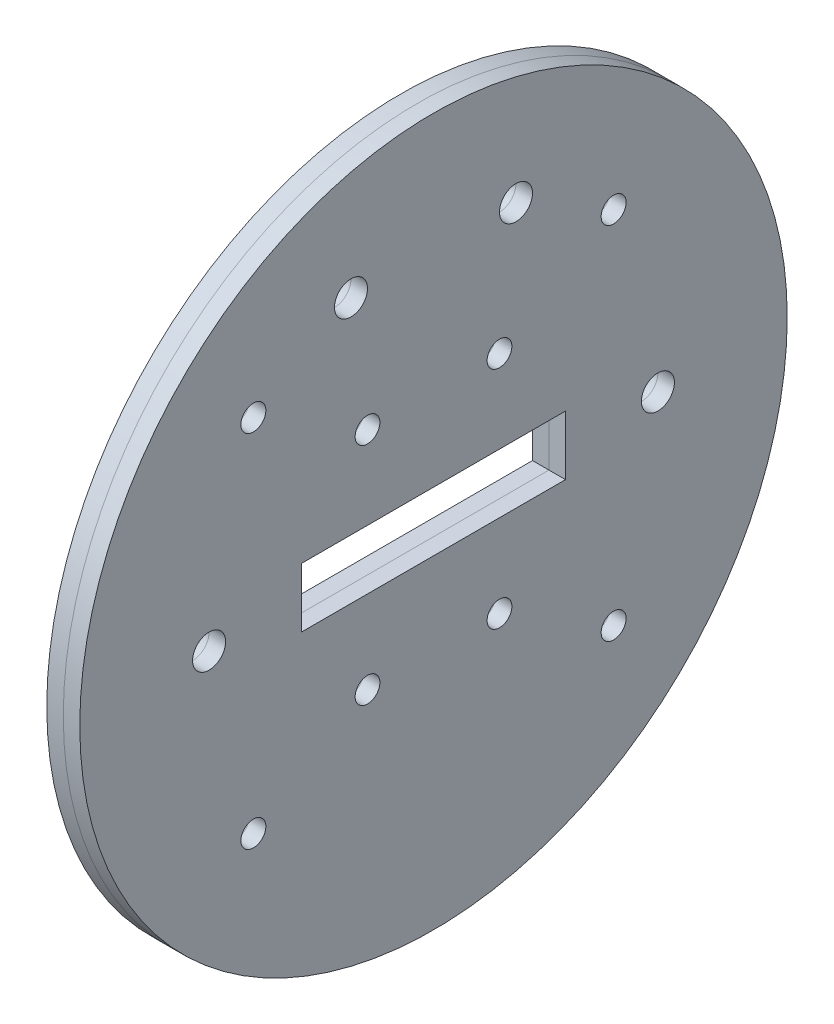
SolidWorks part; units mm, degrees
ref_plane "Front Plane" through (0, 0, 0) normal (0, 0, 1) x (1, 0, 0)
ref_plane "Top Plane" through (0, 0, 0) normal (0, 1, 0) x (1, 0, 0)
ref_plane "Right Plane" through (0, 0, 0) normal (1, 0, 0) x (0, 0, -1)
sketch "Sketch1" plane through (0, 0, 0) normal (1, 0, 0) x (0, 0, -1)
  circle A0 centre (0, 0) radius 68.072
  dimension "D1" = 136.144
extrude "Boss-Extrude1" add sketch "Sketch1" along normal blind 3.175
sketch "Sketch4" plane through (3.175, 0, 0) normal (1, 0, 0) x (0, 0, -1)
  circle A0 centre (0, 0) radius 68.072
extrude "Boss-Extrude2" add sketch "Sketch4" along normal blind 3.175 separate body
sketch "Sketch2" plane through (3.175, 0, 0) normal (1, 0, 0) x (0, 0, -1)
  line L0 (0, 68.072) -> (0, -68.072) construction
  circle A3 centre (0, 0) radius 68.072 construction
  circle A4 centre (43.18, 0) radius 3.175
  circle A5 centre (-43.18, 0) radius 3.175
  point P6 (0, 0)
  dimension "D1" = 6.35
  dimension "D2" = 43.18
extrude "Cut-Extrude1" cut sketch "Sketch2" against normal through all both and the other way through all
sketch "Sketch3" plane through (3.175, 0, 0) normal (1, 0, 0) x (0, 0, -1)
  line L1 (-25.4, 5.715) -> (25.4, 5.715)
  line L2 (-25.4, 5.715) -> (-25.4, -5.715)
  line L3 (-25.4, -5.715) -> (25.4, -5.715)
  line L4 (25.4, 5.715) -> (25.4, -5.715)
  line L5 (-25.4, 5.715) -> (25.4, -5.715) construction
  line L6 (-25.4, -5.715) -> (25.4, 5.715) construction
  point P0 (0, 0)
  dimension "D2" = 11.43
  dimension "D3" = 50.8
extrude "Cut-Extrude2" cut sketch "Sketch3" against normal through all both and the other way through all
sketch "Sketch5" plane through (6.35, 0, 0) normal (1, 0, 0) x (0, 0, -1)
  line L0 (0, 75.0273) -> (0, -75.0273) construction
  circle A0 centre (-15.875, 45.212) radius 3.175
  circle A1 centre (15.875, 45.212) radius 3.175
  point P6 (0, 0)
  dimension "D2" = 6.35
  dimension "D1" = 15.875
  dimension "D3" = 45.212
extrude "Cut-Extrude3" cut sketch "Sketch5" against normal through all
sketch "Sketch6" plane through (6.35, 0, 0) normal (1, 0, 0) x (0, 0, -1)
  line L0 (25.4, 5.715) -> (-25.4, 5.715) construction
  line L1 (0, 0) -> (0, 44.217) construction
  line L2 (-22.9828, 0) -> (23.1494, 0) construction
  line L3 (-25.4, 5.715) -> (-25.4, -5.715) construction
  circle A0 centre (-12.7, 21.6687) radius 2.3813
  circle A2 centre (12.7, 21.6687) radius 2.3813
  circle A3 centre (12.7, -21.6687) radius 2.3813
  circle A4 centre (-12.7, -21.6687) radius 2.3813
  dimension "D1" = 15.9537
  dimension "D2" = 4.7625
  dimension "D3" = 12.7
extrude "Cut-Extrude4" cut sketch "Sketch6" against normal through all
sketch "Sketch7" plane through (6.35, 0, 0) normal (1, 0, 0) x (0, 0, -1)
  line L0 (-23.649, 0) -> (22.1501, 0) construction
  line L1 (0, 0) -> (-34.6638, -34.6638) construction
  line L2 (0, 0) -> (-34.6638, 34.6638) construction
  circle A0 centre (-34.6638, -34.6638) radius 2.4003
  circle A1 centre (0, 0) radius 68.072 construction
  circle A2 centre (-34.6638, 34.6638) radius 2.4003
  circle A3 centre (34.6638, 34.6638) radius 2.4003
  circle A4 centre (34.6638, -34.6638) radius 2.4003
  point P17 (0, 0)
  dimension "D1" = 4.8006
  dimension "D2" = 49.022
  dimension "D3" = 45
  dimension "D5" = 49.022
  dimension "D6" = 45
  dimension "D4" = 4
extrude "Cut-Extrude5" cut sketch "Sketch7" against normal through all
